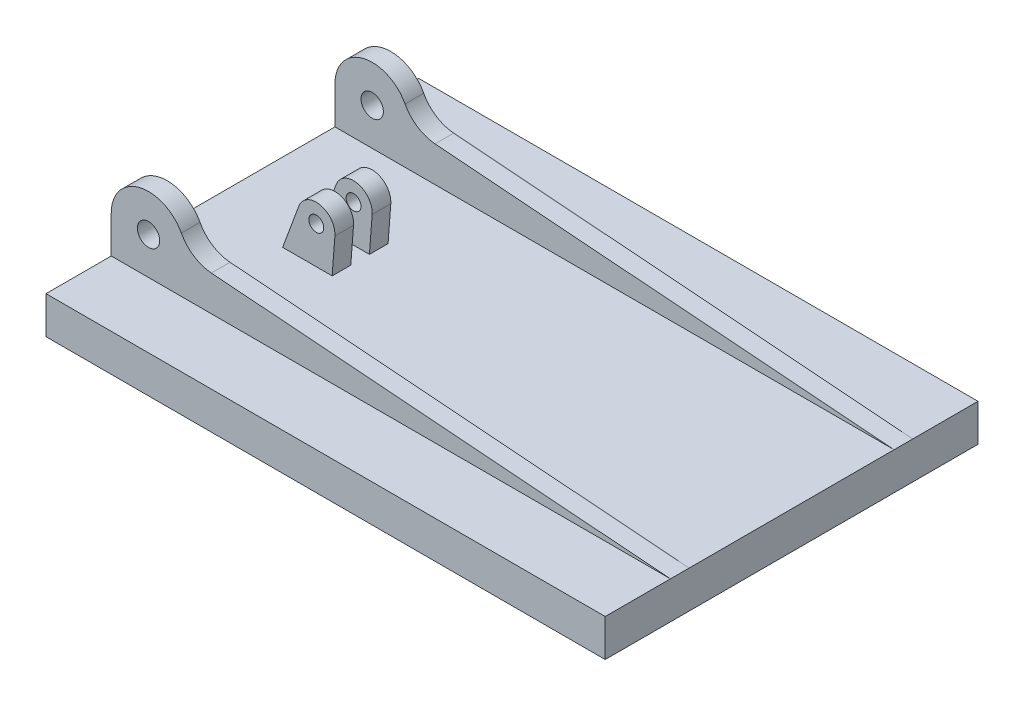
SolidWorks part; units mm, degrees
ref_plane "Plan de face" through (0, 0, 0) normal (0, 0, 1) x (1, 0, 0)
ref_plane "Plan de dessus" through (0, 0, 0) normal (0, 1, 0) x (1, 0, 0)
ref_plane "Plan de droite" through (0, 0, 0) normal (1, 0, 0) x (0, 0, -1)
sketch "Esquisse1" plane through (0, 0, 0) normal (0, 1, 0) x (1, 0, 0)
  line L1 (0, 500) -> (1500, 500)
  line L2 (0, 500) -> (0, -500)
  line L3 (0, -500) -> (1500, -500)
  line L4 (1500, 500) -> (1500, -500)
  dimension "D1" = 1500
  dimension "D2" = 1000
  dimension "D3" = 500
extrude "Boss.-Extru.1" add sketch "Esquisse1" against normal blind 100
ref_plane "Plan1" through (0, 0, -300) normal (0, 0, 1) x (1, 0, 0)
sketch "Esquisse2" plane through (0, 0, -300) normal (0, 0, 1) x (1, 0, 0)
  line L1 (0, 100) -> (0, 0)
  line L2 (0, 0) -> (1500, 0)
  line L3 (200, 100) -> (1500, 0)
  arc A0 (200, 100) -> (0, 100) centre (100, 100) ccw
extrude "Boss.-Extru.2" add sketch "Esquisse2" along normal mid plane 50
mirror "Symétrie1" about plane through (0, 0, 0) normal (0, 0, 1) of "Boss.-Extru.2"
sketch "Esquisse3" plane through (0, 0, 325) normal (0, 0, 1) x (1, 0, 0)
  circle A0 centre (100, 100) radius 30
extrude "Enlèv. mat.-Extru.1" cut sketch "Esquisse3" against normal through all
fillet "Congé1" radius 100 2 edges at (200, 100, -300) (200, 100, 300)
ref_plane "Plan2" through (0, 0, 50) normal (0, 0, 1) x (1, 0, 0)
sketch "Esquisse4" plane through (0, 0, 50) normal (0, 0, 1) x (1, 0, 0)
  line L0 (209.7666, 0) -> (253.0966, 117.3225)
  line L1 (0, 0) -> (1500, 0) construction
  line L2 (342.5566, 0) -> (349.8567, 96.2173)
  line L3 (0, 0) -> (1500, 0) construction
  line L4 (209.7666, 0) -> (342.5566, 0)
  arc A0 (349.8567, 96.2173) -> (253.0966, 117.3225) centre (300, 100) ccw
  circle A1 centre (300, 100) radius 20
  dimension "D1" = 100
  dimension "D2" = 100
  dimension "D3" = 300
extrude "Boss.-Extru.3" add sketch "Esquisse4" along normal mid plane 50
mirror "Symétrie2" about plane through (0, 0, 0) normal (0, 0, 1) of "Boss.-Extru.3"
